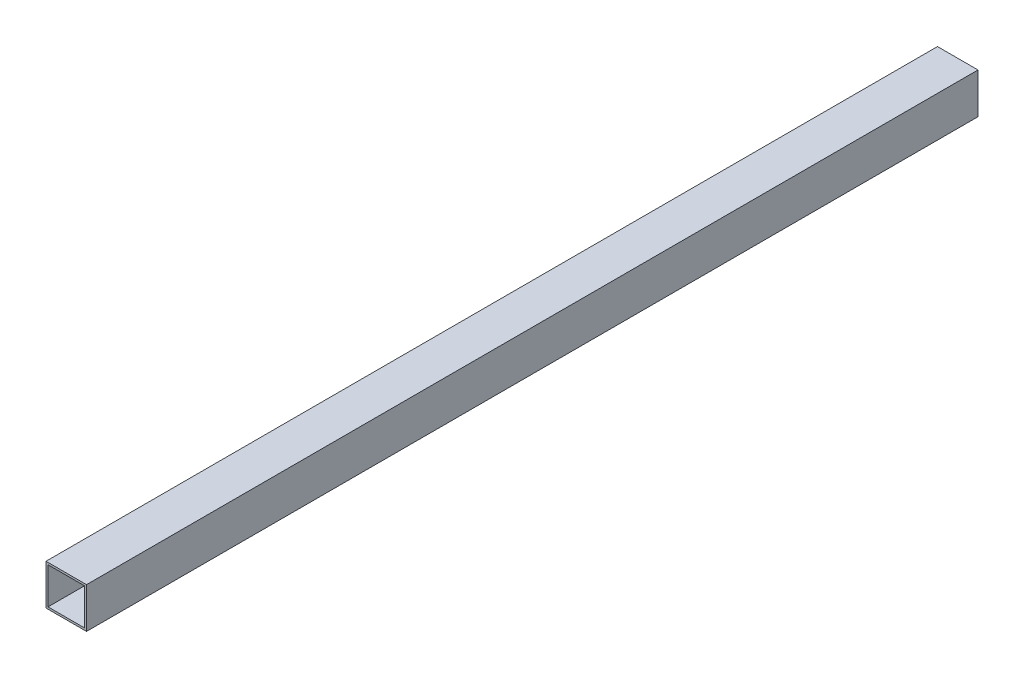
SolidWorks part; units mm, degrees
ref_plane "Plan de face" through (0, 0, 0) normal (0, 0, 1) x (1, 0, 0)
ref_plane "Plan de dessus" through (0, 0, 0) normal (0, 1, 0) x (1, 0, 0)
ref_plane "Plan de droite" through (0, 0, 0) normal (1, 0, 0) x (0, 0, -1)
sketch "Esquisse1" plane through (0, 0, 0) normal (0, 0, 1) x (1, 0, 0)
  line L0 (5, 95) -> (95, 95)
  line L1 (0, 0) -> (100, 0)
  line L2 (0, 0) -> (0, 100)
  line L3 (0, 100) -> (100, 100)
  line L4 (100, 0) -> (100, 100)
  line L5 (95, 5) -> (95, 95)
  line L6 (5, 5) -> (95, 5)
  line L7 (5, 5) -> (5, 95)
  dimension "D1" = 100
  dimension "D2" = 100
  dimension "D3" = 5
extrude "Boss.-Extru.1" add sketch "Esquisse1" along normal blind 2200
